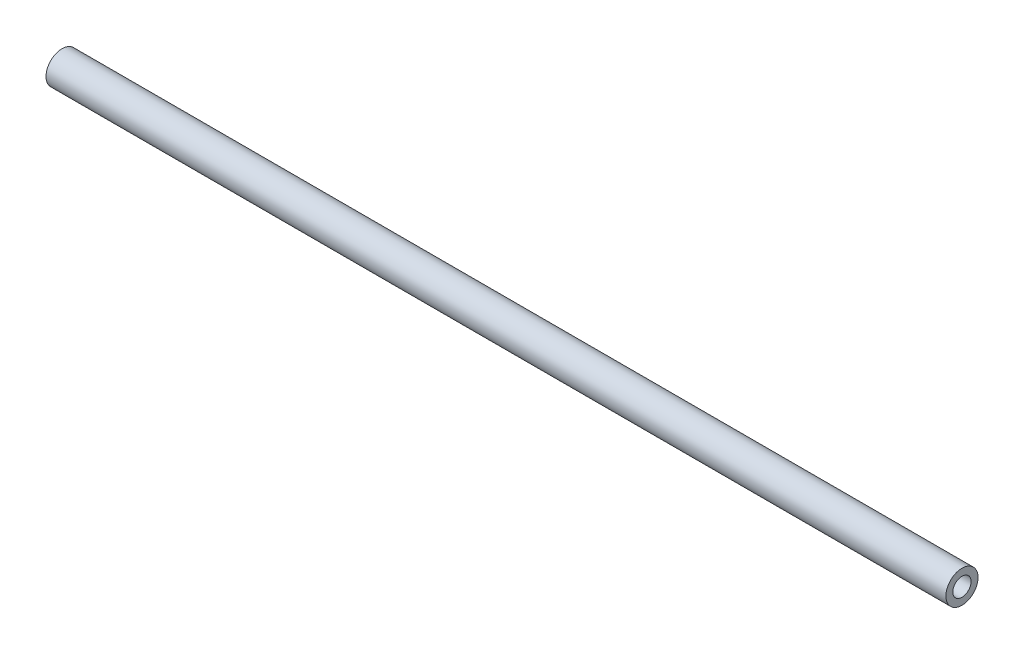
SolidWorks part; units mm, degrees
ref_plane "Front Plane" through (0, 0, 0) normal (0, 0, 1) x (1, 0, 0)
ref_plane "Top Plane" through (0, 0, 0) normal (0, 1, 0) x (1, 0, 0)
ref_plane "Right Plane" through (0, 0, 0) normal (1, 0, 0) x (0, 0, -1)
sketch "Sketch1" plane through (0, 0, 0) normal (0, 0, 1) x (1, 0, 0)
  line L0 (-66.675, 0) -> (66.675, 0)
  line L1 (66.675, 0) -> (66.675, 2.3813)
  line L2 (66.675, 2.3813) -> (-66.675, 2.3812)
  line L3 (-66.675, 2.3812) -> (-66.675, 0)
  line L4 (0, 0) -> (168.8341, 0) construction
  dimension "D1" = 4.7625
  dimension "D2" = 133.35
revolve "Revolve1" add sketch "Sketch1" angle 360 about L4
hole_wizard "#6-32 Tapped Hole1" positions "3DSketch1" profile "Sketch2" tap size "#6-32" standard "ANSI Inch"
sketch3d "3DSketch1"
  line L0 (66.675, 0, 0) -> (-66.675, 0, 0) construction
  point P0 (66.675, 0, 0)
  point P4 (-66.675, 0, 0)
sketch "Sketch2" plane through (66.675, 0, 0) normal (0, 1, 0) x (0, 0, -1)
  line L0 (0, 0) -> (0, 13.5127)
  line L1 (0, 13.5127) -> (1.3525, 12.7)
  line L2 (1.3525, 12.7) -> (1.3525, 0)
  line L5 (1.3525, 0) -> (0, 0)
  line L10 (0, 13.5127) -> (-1.3526, 12.7) construction
  line L11 (0, -6.35) -> (0, 107.95) construction
  dimension "Tap Drill Dia." = 2.7051
  dimension "Tap Drill Depth" = 12.7
  dimension "Drill Angle" = 118
